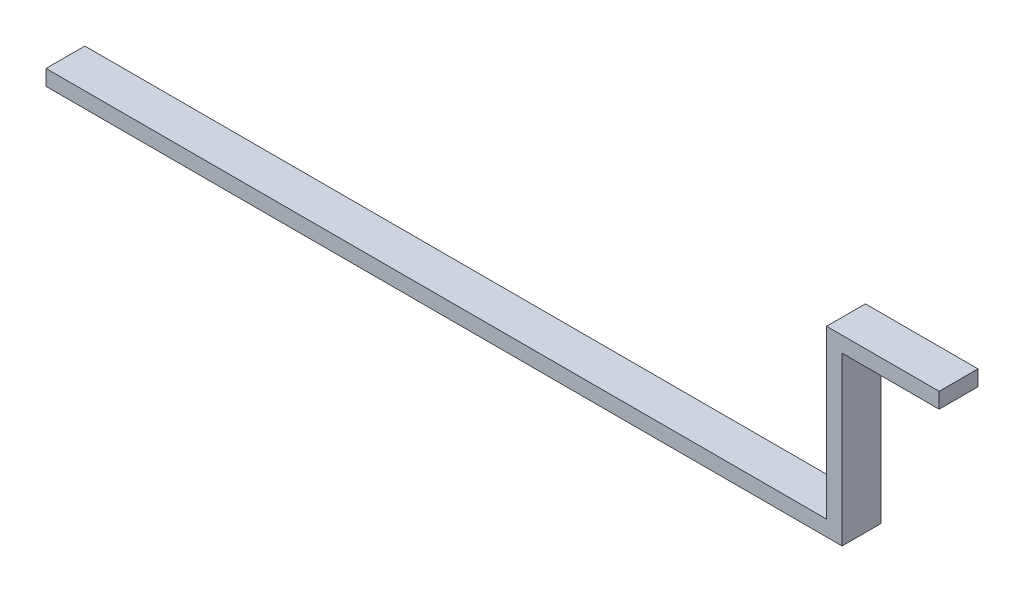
SolidWorks part; units mm, degrees
ref_plane "Face" through (0, 0, 0) normal (0, 0, 1) x (1, 0, 0)
ref_plane "Dessus" through (0, 0, 0) normal (0, 1, 0) x (1, 0, 0)
ref_plane "Droite" through (0, 0, 0) normal (1, 0, 0) x (0, 0, -1)
sketch "Esquisse1" plane through (0, 0, 0) normal (0, 0, 1) x (1, 0, 0)
  line L0 (-2.6411, 0) -> (45.8703, 0) construction
  line L1 (11, 0) -> (141, 0) construction
  line L2 (45, 13.4) -> (39.2, 13.4)
  line L3 (45, 55) -> (45, -55) construction
  line L4 (39.2, 13.4) -> (39.2, 4.8)
  line L5 (39.2, 4.8) -> (-1, 4.8)
  line L6 (-1, 4.8) -> (-1, 4)
  line L7 (-1, 4) -> (40, 4)
  line L8 (40, 4) -> (40, 12.6)
  line L9 (40, 12.6) -> (45, 12.6)
  line L10 (45, 12.6) -> (45, 13.4)
  dimension "D1" = 12.6
  dimension "D2" = 0.8
  dimension "D3" = 0.8
  dimension "D4" = 0.8
  dimension "D5" = 46
  dimension "D6" = 5
  dimension "D7" = 4
extrude "Base-Extrusion" add sketch "Esquisse1" along normal mid plane 2
